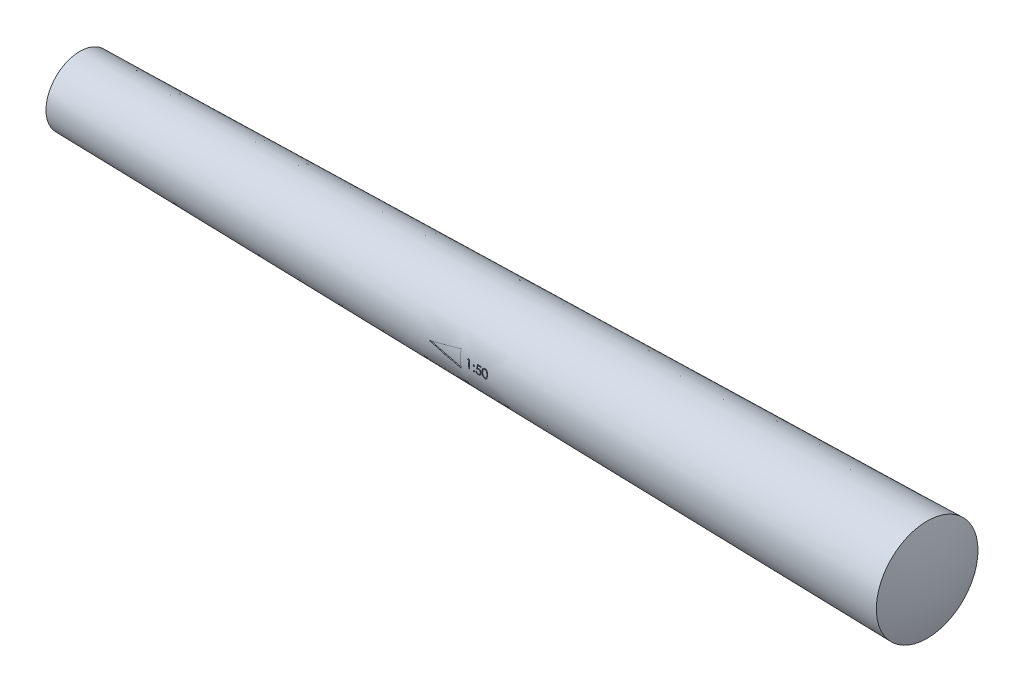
SolidWorks part; units mm, degrees
ref_plane "Front Plane" through (0, 0, 0) normal (0, 0, 1) x (1, 0, 0)
ref_plane "Top Plane" through (0, 0, 0) normal (0, 1, 0) x (1, 0, 0)
ref_plane "Right Plane" through (0, 0, 0) normal (1, 0, 0) x (0, 0, -1)
sketch "Sketch1" plane through (0, 0, 0) normal (1, 0, 0) x (0, 0, -1)
  circle A0 centre (0, 0) radius 4
  dimension "D1" = 8
extrude "Extrude1" add sketch "Sketch1" along normal mid plane 100
draft "Draft1" type of draft neutral plane draft angle 1.146 faces to draft 1 parameters "D1"=1.146
sketch "Sketch2" plane through (0, 0, 0) normal (0, 0, 1) x (1, 0, 0)
  line L0 (-50, 0) -> (-50, 4)
  line L1 (-50, 4) -> (-50, -4) construction
  line L2 (-50, 0) -> (-51, 0)
  line L3 (-51, 0) -> (-51, -5) construction
  line L4 (50, 0) -> (50, 6.0001)
  line L5 (50, -6.0001) -> (50, 6.0001) construction
  line L6 (50, 0) -> (51, 0)
  line L7 (51, 0) -> (51, -5) construction
  line L8 (-50, -4) -> (50, -6.0001) construction
  arc A0 (-51, 0) -> (-50, 4) centre (-42.5, 0) cw
  arc A1 (51, 0) -> (50, 6.0001) centre (32.4996, 0) ccw
  point P14 (0, -5)
revolve "Revolve1" add sketch "Sketch2" angle 360 about L2
sketch "Sketch5" plane through (0, 0, 0) normal (0, 0, 1) x (1, 0, 0)
  line L0 (0, 5) -> (0, -5) construction
  line L1 (50, 6.0001) -> (-50, 4) construction
  line L2 (-50, -4) -> (50, -6.0001) construction
ref_plane "Plane2" through (0, 0, 0) normal (-0.02, 0, 0.9998) x (0.9998, 0, 0.02)
sketch "Sketch6" plane through (0, 0, 0) normal (-0.02, 0, 0.9998) x (0.9998, 0, 0.02)
  line L0 (0, 0) -> (0, 1)
  line L1 (0, 5) -> (0, -5) construction
  line L2 (0, 1) -> (-3.7321, 0)
  line L3 (-3.7321, 0) -> (0, -1)
  line L4 (0, -1) -> (0, 0)
  line L5 (0, -0.5) -> (4, -0.5) construction
  text T0 "1:50" font "Century Gothic" height 1
  dimension "D1" = 2
  dimension "D2" = 30
  dimension "D3" = 4
wrap "Wrap2" sketch "Sketch6" wrap type deboss source sketch "Sketch6" thickness 0.1 parameters "D1"=0.1
equation "\"D2@Sketch2\" = \"D1@Sketch2\""
